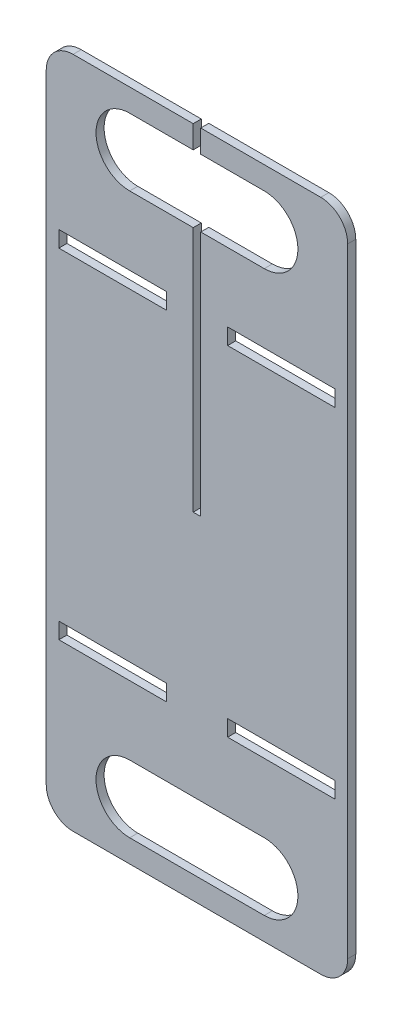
SolidWorks part; units mm, degrees
ref_plane "Front" through (0, 0, 0) normal (0, 0, 1) x (1, 0, 0)
ref_plane "Top" through (0, 0, 0) normal (0, 1, 0) x (1, 0, 0)
ref_plane "Right" through (0, 0, 0) normal (1, 0, 0) x (0, 0, -1)
sketch "Sketch1" plane through (0, 0, 0) normal (0, 0, 1) x (1, 0, 0)
  line L0 (1.4, 125) -> (56, 125)
  line L1 (-56, -125) -> (56, -125)
  line L2 (-56, -125) -> (-56, 125)
  line L3 (-56, 125) -> (-1.4, 125)
  line L4 (56, -125) -> (56, 125)
  line L5 (-56, -125) -> (56, 125) construction
  line L6 (-56, 125) -> (56, -125) construction
  line L8 (-1.4, 125) -> (-1.4, 0)
  line L9 (-1.4, 0) -> (1.4, 0)
  line L10 (1.4, 125) -> (1.4, 0)
  point P0 (0, 0)
  point P10 (0, 0)
  dimension "D1" = 112
  dimension "D2" = 250
  dimension "D3" = 2.8
extrude "Boss-Extrude1" add sketch "Sketch1" along normal blind 3
sketch "Sketch2" plane through (0, 0, 0) normal (0, 0, -1) x (-1, 0, 0)
  line L0 (-1.4, 125) -> (-1.4, 0) construction
  line L1 (-51.3, 66) -> (-11.4, 66)
  line L2 (-51.3, 66) -> (-51.3, 60)
  line L3 (-51.3, 60) -> (-11.4, 60)
  line L4 (-11.4, 66) -> (-11.4, 60)
  line L5 (-56, 125) -> (-1.4, 125) construction
  line L9 (56, -125) -> (-56, -125) construction
  line L10 (-11.4, -60) -> (-51.3, -60)
  line L11 (-11.4, -60) -> (-11.4, -66)
  line L12 (-11.4, -66) -> (-51.3, -66)
  line L13 (-51.3, -60) -> (-51.3, -66)
  dimension "D1" = 39.9
  dimension "D2" = 6
  dimension "D3" = 10
  dimension "D4" = 59
  dimension "D5" = 10
  dimension "D6" = 59
extrude "Cut-Extrude1" cut sketch "Sketch2" against normal through all
mirror "Mirror1" about plane through (0, 0, 0) normal (1, 0, 0) of "Cut-Extrude1"
fillet "Fillet1" radius 10 4 edges at (-56, -125, 1.5) (56, -125, 1.5) (-56, 125, 1.5) (56, 125, 1.5)
sketch "Sketch3" plane through (0, 0, 0) normal (0, 0, -1) x (-1, 0, 0)
  line L0 (-25, -104.0535) -> (25, -104.0535) construction
  line L1 (-25, -91.5535) -> (25, -91.5535)
  line L2 (-25, -116.5535) -> (25, -116.5535)
  arc A0 (-25, -91.5535) -> (-25, -116.5535) centre (-25, -104.0535) ccw
  arc A1 (25, -116.5535) -> (25, -91.5535) centre (25, -104.0535) ccw
  point P2 (0, -104.0535)
  dimension "D1" = 25
  dimension "D2" = 50
extrude "Cut-Extrude2" cut sketch "Sketch3" against normal through all
mirror "Mirror2" about plane through (0, 0, 0) normal (0, 1, 0) of "Cut-Extrude2"
